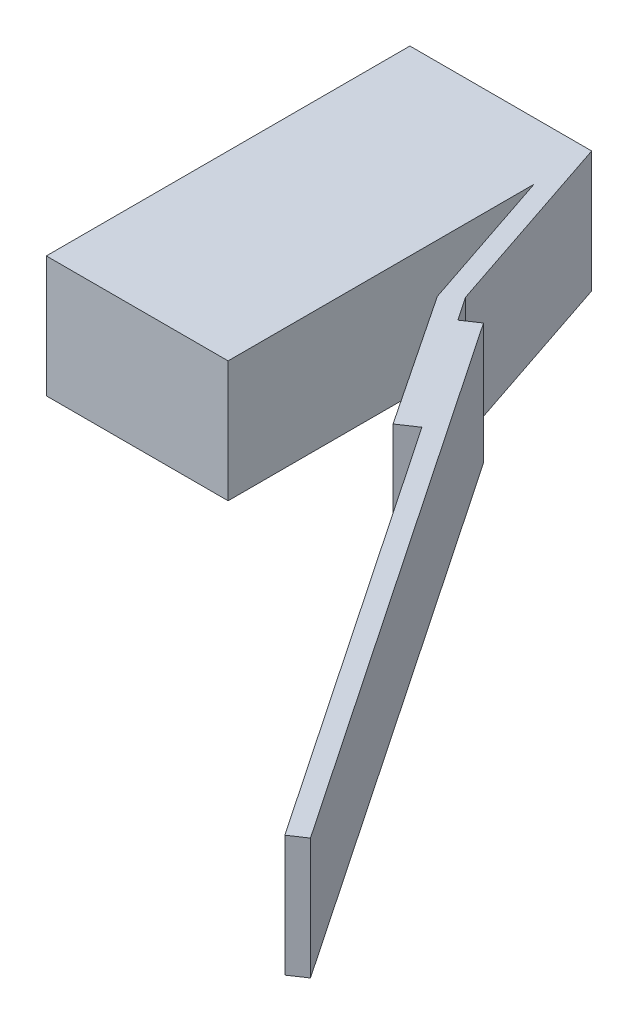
SolidWorks part; units mm, degrees
ref_plane "Front" through (0, 0, 0) normal (0, 0, 1) x (1, 0, 0)
ref_plane "Top" through (0, 0, 0) normal (0, 1, 0) x (1, 0, 0)
ref_plane "Right" through (0, 0, 0) normal (1, 0, 0) x (0, 0, -1)
sketch "Sketch1" plane through (0, 0, 0) normal (0, 1, 0) x (1, 0, 0)
  line L0 (0, 0) -> (0, 19.05)
  line L1 (0, 19.05) -> (9.525, 19.05)
  line L2 (9.525, 16.0283) -> (9.525, 0)
  line L3 (9.525, 0) -> (0, 0)
  line L4 (9.525, 19.05) -> (12.8562, 9.113)
  line L5 (13.6966, 7.8679) -> (14.4983, 8.4091)
  line L6 (12.0792, 8.4091) -> (9.525, 16.0283)
  line L8 (12.8562, 9.113) -> (13.6966, 7.8679)
  line L9 (17.6129, 2.0667) -> (16.7102, 1.4573)
  line L10 (16.7102, 1.4573) -> (12.0792, 8.4091)
  line L11 (14.4983, 8.4091) -> (33.3356, -19.4954)
  line L12 (33.3356, -19.4954) -> (32.534, -20.0365)
  line L13 (32.534, -20.0365) -> (17.6129, 2.0667)
  dimension "D1" = 19.05
  dimension "D2" = 9.525
extrude "Extrude1" add sketch "Sketch1" along normal blind 6.35
